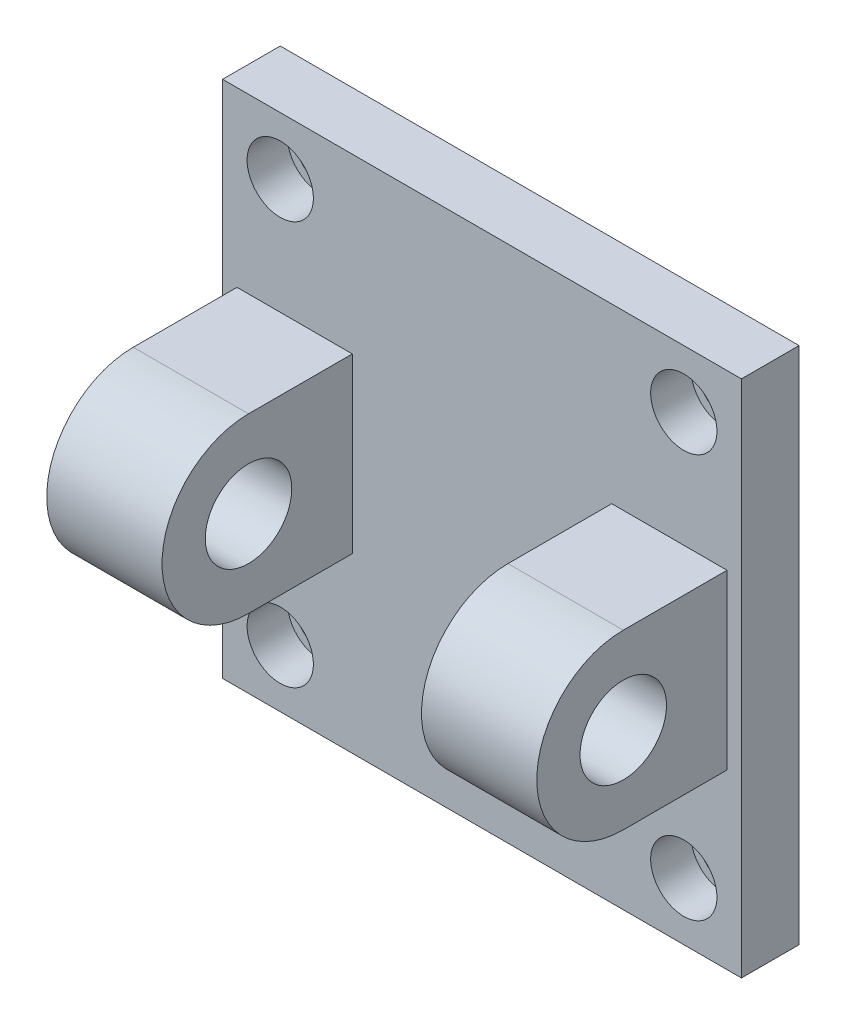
SolidWorks part; units mm, degrees
ref_plane "Спереди" through (0, 0, 0) normal (0, 0, 1) x (1, 0, 0)
ref_plane "Сверху" through (0, 0, 0) normal (0, 1, 0) x (1, 0, 0)
ref_plane "Справа" through (0, 0, 0) normal (1, 0, 0) x (0, 0, -1)
sketch "Эскиз1" plane through (0, 0, 0) normal (0, 0, 1) x (1, 0, 0)
  line L1 (90, 90) -> (-90, 90)
  line L2 (90, 90) -> (90, -90)
  line L3 (90, -90) -> (-90, -90)
  line L4 (-90, 90) -> (-90, -90)
  line L5 (90, 90) -> (-90, -90) construction
  line L6 (90, -90) -> (-90, 90) construction
  point P0 (0, 0)
  dimension "D1" = 180
  dimension "D2" = 180
extrude "Бобышка-Вытянуть1" add sketch "Эскиз1" along normal blind 20
sketch "Эскиз4" plane through (-90, 0, 0) normal (-1, 0, 0) x (0, 0, 1)
  line L0 (0, 0) -> (109.4329, 0) construction
  line L1 (20, 30) -> (56, 30)
  line L2 (20, 90) -> (20, -90) construction
  line L3 (20, 30) -> (20, -30)
  line L4 (56, -30) -> (20, -30)
  arc A0 (56, -30) -> (56, 30) centre (56, 0) ccw
  dimension "D3" = 30
  dimension "D4" = 36
  dimension "D1" = 30
  dimension "D2" = 30
extrude "Бобышка-Вытянуть2" add sketch "Эскиз4" against normal blind 180
sketch "Эскиз5" plane through (0, 0, 20) normal (0, 0, 1) x (1, 0, 0)
  line L0 (-90, -90) -> (90, -90) construction
  line L1 (-90, 90) -> (-85, 90)
  line L2 (-90, 90) -> (-90, -90)
  line L3 (-90, -90) -> (-85, -90)
  line L4 (-85, 90) -> (-85, -90)
  line L5 (90, 90) -> (-90, 90) construction
  line L6 (90, 90) -> (85, 90)
  line L7 (90, 90) -> (90, -90)
  line L8 (90, -90) -> (85, -90)
  line L9 (85, 90) -> (85, -90)
  line L10 (-45, 90) -> (45, 90)
  line L11 (-45, 90) -> (-45, -90)
  line L12 (-45, -90) -> (45, -90)
  line L13 (45, 90) -> (45, -90)
  dimension "D1" = 5
  dimension "D2" = 5
  dimension "D3" = 40
  dimension "D4" = 40
extrude "Вырез-Вытянуть1" cut sketch "Эскиз5" along normal blind 70
sketch "Эскиз6" plane through (-85, 0, 0) normal (-1, 0, 0) x (0, 0, 1)
  circle A0 centre (56, 0) radius 15
  dimension "D1" = 30
extrude "Вырез-Вытянуть2" cut sketch "Эскиз6" against normal through all
sketch "Эскиз7" plane through (0, 0, 20) normal (0, 0, 1) x (1, 0, 0)
  line L0 (-70, 70) -> (70, 70) construction
  line L1 (70, 70) -> (70, -70) construction
  line L2 (70, -70) -> (-70, -70) construction
  line L3 (-70, -70) -> (-70, 70) construction
  line L4 (0, 0) -> (0, -90) construction
  line L5 (-90, -90) -> (90, -90) construction
  circle A0 centre (-70, 70) radius 8.5
  circle A1 centre (70, 70) radius 8.5
  circle A2 centre (70, -70) radius 8.5
  circle A3 centre (-70, -70) radius 8.5
  dimension "D1" = 17
  dimension "D2" = 17
  dimension "D3" = 17
  dimension "D4" = 17
  dimension "D5" = 140
  dimension "D6" = 140
  dimension "D7" = 70
  dimension "D8" = 70
extrude "Вырез-Вытянуть3" cut sketch "Эскиз7" against normal through all
sketch "Эскиз8" plane through (0, 0, 20) normal (0, 0, 1) x (1, 0, 0)
  circle A0 centre (-70, 70) radius 11.5
  circle A1 centre (70, 70) radius 11.5
  circle A2 centre (-70, -70) radius 11.5
  circle A3 centre (70, -70) radius 11.5
  dimension "D1" = 23
  dimension "D2" = 23
  dimension "D3" = 23
  dimension "D4" = 23
extrude "Вырез-Вытянуть4" cut sketch "Эскиз8" against normal blind 14
